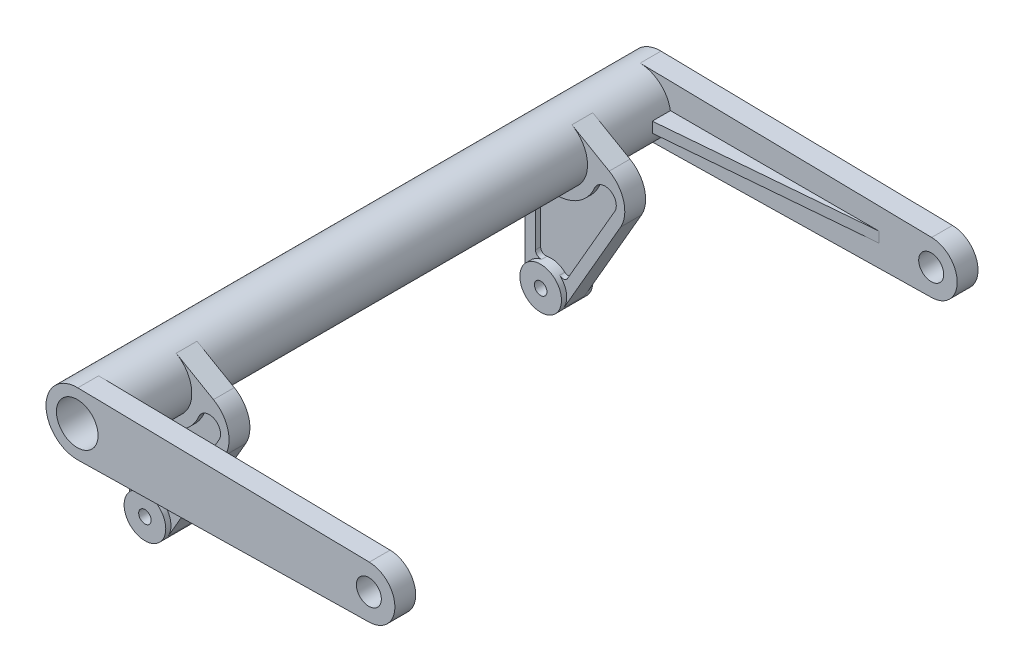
SolidWorks part; units mm, degrees
ref_plane "Face" through (0, 0, 0) normal (0, 0, 1) x (1, 0, 0)
ref_plane "Dessus" through (0, 0, 0) normal (0, 1, 0) x (1, 0, 0)
ref_plane "Droite" through (0, 0, 0) normal (1, 0, 0) x (0, 0, -1)
sketch "Esquisse1" plane through (0, 0, 0) normal (0, 0, 1) x (1, 0, 0)
  circle A1 centre (0, 0) radius 30
  dimension "D1" = 60
extrude "Base-Extrusion" add sketch "Esquisse1" along normal mid plane 560
sketch "Esquisse3" plane through (0, 0, 280) normal (0, 0, 1) x (1, 0, 0)
  line L0 (0.5357, 29.9952) -> (280.4464, 24.996)
  line L1 (0.5357, -29.9952) -> (280.4464, -24.996)
  arc A0 (0.5357, 29.9952) -> (0.5357, -29.9952) centre (0, 0) ccw
  arc A1 (280.4464, -24.996) -> (280.4464, 24.996) centre (280, 0) ccw
  circle A2 centre (280, 0) radius 12
  dimension "D1" = 50
  dimension "D2" = 60
  dimension "D4" = 24
  dimension "D3" = 280
extrude "Boss.-Extru.1" add sketch "Esquisse3" against normal blind 20
sketch "Esquisse4" plane through (0, 0, 0) normal (0, 1, 0) x (1, 0, 0)
  line L0 (0, -240) -> (0.5357, -260)
  line L1 (0, -280) -> (0, -260) construction
  line L2 (0.5357, -260) -> (230, -260)
  line L3 (280.4464, -260) -> (0.5357, -260) construction
  line L4 (0, -240) -> (230, -260)
  dimension "D1" = 20
extrude "Boss.-Extru.2" add sketch "Esquisse4" along normal mid plane 10
ref_plane "Plan1" through (0, 0, 200) normal (0, 0, 1) x (1, 0, 0)
sketch "Esquisse5" plane through (0, 0, 200) normal (0, 0, 1) x (1, 0, 0)
  line L0 (15, 25.9808) -> (50.8013, 5.3109)
  line L1 (61.782, -35.6699) -> (7.3205, -130)
  line L2 (-30, 0) -> (-30, -120)
  arc A0 (15, 25.9808) -> (-30, 0) centre (0, 0) ccw
  arc A1 (-30, -120) -> (7.3205, -130) centre (-10, -120) ccw
  circle A2 centre (-10, -120) radius 6
  arc A3 (50.8013, 5.3109) -> (61.782, -35.6699) centre (35.8013, -20.6699) cw
  dimension "D1" = 12
  dimension "D3" = 60
  dimension "D4" = 40
  dimension "D6" = 30
  dimension "D2" = 120
  dimension "D5" = 30
extrude "Boss.-Extru.3" add sketch "Esquisse5" against normal blind 20
sketch "Esquisse6" plane through (0, 0, 200) normal (0, 0, 1) x (1, 0, 0)
  line L0 (-20, -42.4264) -> (-20, -95.5051)
  line L1 (56.1587, -25.4098) -> (10.9077, -103.7868)
  line L2 (-30, 0) -> (-30, -120) construction
  line L3 (7.3205, -130) -> (61.782, -35.6699) construction
  arc A0 (3.2621, -105.0294) -> (-14, -100.4041) centre (-10, -120) ccw
  arc A1 (-13.3333, -37.7124) -> (36.7819, -15.7193) centre (0, 0) ccw
  arc A2 (56.1587, -25.4098) -> (36.7819, -15.7193) centre (46.7607, -19.9839) ccw
  arc A3 (-20, -42.4264) -> (-13.3333, -37.7124) centre (-15, -42.4264) cw
  arc A4 (-20, -95.5051) -> (-14, -100.4041) centre (-15, -95.5051) ccw
  arc A5 (10.9077, -103.7868) -> (3.2621, -105.0294) centre (6.5776, -101.2868) cw
  dimension "D3" = 80
  dimension "D4" = 40
  dimension "D6" = 5
  dimension "D1" = 10
  dimension "D2" = 10
  dimension "D5" = 115
extrude "Enlèv. mat.-Extru.1" cut sketch "Esquisse6" against normal blind 5
sketch "Esquisse7" plane through (0, 0, 180) normal (0, 0, -1) x (-1, 0, 0)
  line L0 (20, -42.4264) -> (20, -95.5051)
  line L1 (-56.1587, -25.4098) -> (-10.9077, -103.7868)
  line L2 (-7.3205, -130) -> (-61.782, -35.6699) construction
  line L3 (30, 0) -> (30, -120) construction
  arc A0 (14, -100.4041) -> (-3.2621, -105.0294) centre (10, -120) ccw
  arc A1 (-36.7819, -15.7193) -> (13.3333, -37.7124) centre (0, 0) ccw
  arc A2 (-36.7819, -15.7193) -> (-56.1587, -25.4098) centre (-46.7607, -19.9839) ccw
  arc A3 (20, -42.4264) -> (13.3333, -37.7124) centre (15, -42.4264) ccw
  arc A4 (20, -95.5051) -> (14, -100.4041) centre (15, -95.5051) cw
  arc A5 (-3.2621, -105.0294) -> (-10.9077, -103.7868) centre (-6.5776, -101.2868) cw
  dimension "D3" = 80
  dimension "D4" = 40
  dimension "D6" = 5
  dimension "D1" = 10
  dimension "D2" = 10
  dimension "D5" = 115
extrude "Enlèv. mat.-Extru.2" cut sketch "Esquisse7" against normal blind 5
sketch "Esquisse8" plane through (0, 0, 200) normal (0, 0, 1) x (1, 0, 0)
  circle A0 centre (-10, -120) radius 20
  circle A1 centre (-10, -120) radius 6
  dimension "D1" = 40
  dimension "D2" = 12
extrude "Boss.-Extru.4" add sketch "Esquisse8" along normal blind 5
sketch "Esquisse9" plane through (0, 0, 180) normal (0, 0, -1) x (-1, 0, 0)
  circle A0 centre (10, -120) radius 6
  circle A1 centre (10, -120) radius 20
  dimension "D1" = 40
  dimension "D2" = 12
extrude "Boss.-Extru.5" add sketch "Esquisse9" along normal blind 5
mirror "Symétrie1" about plane through (0, 0, 0) normal (0, 0, 1)
sketch "Esquisse10" plane through (0, 0, 280) normal (0, 0, 1) x (1, 0, 0)
  circle A0 centre (0, 0) radius 20
  dimension "D1" = 40
extrude "Enlèv. mat.-Extru.3" cut sketch "Esquisse10" against normal through all
